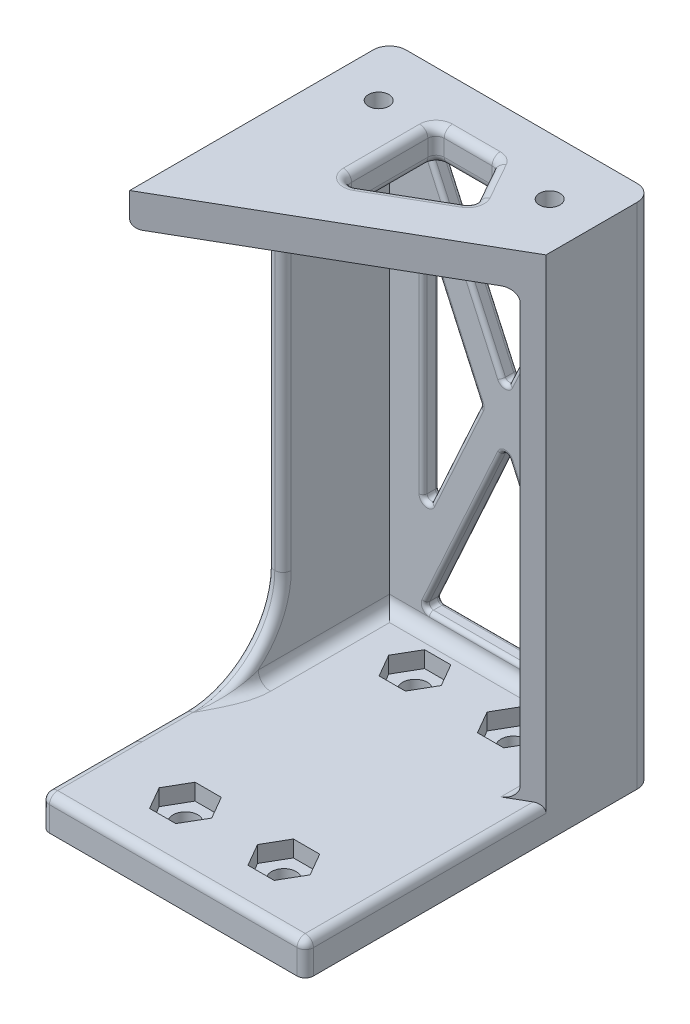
SolidWorks part; units mm, degrees
ref_plane "Front Plane" through (0, 0, 0) normal (0, 0, 1) x (1, 0, 0)
ref_plane "Top Plane" through (0, 0, 0) normal (0, 1, 0) x (1, 0, 0)
ref_plane "Right Plane" through (0, 0, 0) normal (1, 0, 0) x (0, 0, -1)
sketch "Sketch1" plane through (0, 0, 0) normal (0, 1, 0) x (1, 0, 0)
  line L1 (0, 0) -> (32.2, 0)
  line L2 (0, 0) -> (0, 34.25)
  line L3 (0, 34.25) -> (32.2, 34.25)
  line L4 (32.2, 0) -> (32.2, 34.25)
  dimension "D1" = 34.25
  dimension "D2" = 32.2
extrude "Boss-Extrude1" add sketch "Sketch1" along normal blind 4
sketch "Sketch2" plane through (0, 4, 0) normal (0, 1, 0) x (1, 0, 0)
  line L0 (32.2, 34.25) -> (0, 34.25) construction
  line L3 (16.1, 27.25) -> (10.1, 27.25) construction
  line L4 (16.1, 27.25) -> (22.1, 27.25) construction
  line L5 (16.1, 34.25) -> (16.1, 0) construction
  line L6 (0, 0) -> (32.2, 0) construction
  dimension "D1" = 6
  dimension "D2" = 7
ref_plane "Plane1" through (0, 58, 0) normal (0, 1, 0) x (1, 0, 0)
sketch "Sketch5" plane through (0, 58, 0) normal (0, 1, 0) x (1, 0, 0)
  line L1 (0, 34.25) -> (32.2, 34.25)
  line L2 (0, 34.25) -> (0, 0)
  line L3 (0, 0) -> (32.2, 0)
  line L4 (32.2, 34.25) -> (32.2, 0)
  dimension "D1" = 34.25
extrude "Boss-Extrude2" add sketch "Sketch5" along normal blind 4 separate body
sketch "Sketch6" plane through (0, 62, 0) normal (0, 1, 0) x (1, 0, 0)
  line L0 (16.1, 34.25) -> (16.1, 0) construction
  line L1 (32.2, 34.25) -> (0, 34.25) construction
  line L2 (0, 0) -> (32.2, 0) construction
  line L3 (16.1, 27.25) -> (5.67, 27.25) construction
  line L4 (16.1, 27.25) -> (26.53, 27.25) construction
  dimension "D1" = 10.43
  dimension "D2" = 7
sketch "Sketch11" plane through (0, 0, 0) normal (-1, 0, 0) x (0, 0, 1)
  line L0 (-34.25, 4) -> (-34.25, 58)
  line L1 (-34.25, 58) -> (0, 58)
  line L2 (0, 58) -> (0, 4)
  line L3 (0, 4) -> (-34.25, 4)
  line L4 (-34.25, 31) -> (0, 31) construction
extrude "Boss-Extrude3" add sketch "Sketch11" against normal blind 2
sketch "Sketch24" plane through (0, 0, 0) normal (0, -1, 0) x (1, 0, 0)
  line L0 (16.1, -34.25) -> (16.1, 71.9) construction
  line L1 (108.0286, 41.2361) -> (-3.3086, -23.0444)
  line L2 (108.0286, 18.825) -> (108.0286, 124.975) construction
  line L3 (108.0286, 124.975) -> (16.1, 178.05) construction
  line L4 (16.1, 178.05) -> (-75.8286, 124.975) construction
  line L5 (-75.8286, 124.975) -> (-75.8286, 18.825) construction
  line L6 (-75.8286, 18.825) -> (16.1, -34.25) construction
  line L7 (16.1, -34.25) -> (108.0286, 18.825) construction
  line L8 (-3.3086, -23.0444) -> (-39.5686, 39.7597)
  line L9 (108.0286, 41.2361) -> (71.7686, 104.0403)
  line L10 (-39.5686, 39.7597) -> (71.7686, 104.0403)
  circle A0 centre (16.1, 71.9) radius 91.9286 construction
  dimension "D1" = 106.15
  dimension "D2" = 72.52
extrude "Cut-Extrude6" cut sketch "Sketch24" against normal through all
sketch "Sketch26" plane through (32.2, 0, 0) normal (1, 0, 0) x (0, 0, -1)
  line L0 (34.25, 4) -> (34.25, 58)
  line L1 (34.25, 58) -> (2.5435, 58)
  line L2 (2.5435, 58) -> (2.5435, 4)
  line L3 (2.5435, 4) -> (34.25, 4)
extrude "Boss-Extrude5" add sketch "Sketch26" against normal blind 2
sketch "Sketch27" plane through (0, 58, 0) normal (0, 1, 0) x (1, 0, 0)
  line L3 (32.2, 2.5435) -> (30.2, 3.6982)
  line L4 (30.2, 3.6982) -> (30.2, 2.5435)
  line L5 (30.2, 2.5435) -> (32.2, 2.5435)
  line L6 (32.2, 2.5435) -> (30.2, 3.6982)
  line L7 (30.2, 3.6982) -> (30.2, 2.5435)
  line L8 (30.2, 2.5435) -> (32.2, 2.5435)
  dimension "D1" = 0
extrude "Cut-Extrude7" cut sketch "Sketch27" against normal through all
sketch "Sketch28" plane through (32.2, 0, 0) normal (1, 0, 0) x (0, 0, -1)
  line L3 (2.5435, 62) -> (2.5435, 0) construction
  line L7 (19.25, 4) -> (19.25, 58)
  line L8 (19.25, 58) -> (2.5435, 58)
  line L9 (2.5435, 62) -> (34.25, 62) construction
  line L10 (34.25, 0) -> (34.25, 62) construction
  line L11 (2.5435, 0) -> (34.25, 0) construction
  line L12 (19.25, 4) -> (2.5435, 4)
  line L13 (2.5435, 4) -> (2.5435, 58)
  dimension "D1" = 4
  dimension "D4" = 4
  dimension "D6" = 15
extrude "Cut-Extrude8" cut sketch "Sketch28" against normal up to next
sketch "Sketch29" plane through (0, 62, 0) normal (0, 1, 0) x (1, 0, 0)
  line L0 (20.53, 16.2094) -> (9.824, 22.3905)
  line L1 (9.824, 22.3905) -> (13.1097, 28.25)
  line L2 (13.1097, 28.25) -> (20.53, 28.25)
  line L3 (20.53, 28.25) -> (20.53, 16.2094)
  line L4 (32.2, 2.5435) -> (0, 21.1342) construction
  line L5 (32.2, 34.25) -> (0, 34.25) construction
  dimension "D1" = 6
  dimension "D2" = 6
  dimension "D3" = 6
  dimension "D4" = 6
extrude "Cut-Extrude9" cut sketch "Sketch29" against normal up to next
fillet "Fillet2" radius 2 2 edges at (32.2, 31, -34.25) (0, 31, -34.25)
sketch "Sketch31" plane through (2, 0, 0) normal (1, 0, 0) x (0, 0, -1)
  line L0 (34.25, 4) -> (34.25, 58)
  line L1 (34.25, 58) -> (32.25, 58)
  line L2 (19.9795, 58) -> (34.25, 58) construction
  line L3 (32.25, 58) -> (32.25, 4)
  line L4 (34.25, 4) -> (19.9795, 4) construction
  line L5 (32.25, 4) -> (34.25, 4)
  dimension "D1" = 2
extrude "Boss-Extrude6" add sketch "Sketch31" along normal up to next
sketch "Sketch32" plane through (0, 0, -34.25) normal (0, 0, -1) x (-1, 0, 0)
  line L0 (-16.1, 62) -> (-16.1, 0) construction
  line L1 (-30.2, 62) -> (-2, 62) construction
  line L2 (-30.2, 0) -> (-2, 0) construction
  line L3 (-32.2, 31) -> (0, 31) construction
  line L4 (-32.2, 0) -> (-32.2, 62) construction
  line L5 (0, 62) -> (0, 0) construction
  line L6 (-6.0935, 56) -> (-26.1065, 56)
  line L7 (-26.1065, 56) -> (-16.1, 34)
  line L9 (-30.2, 62) -> (-2, 0) construction
  line L10 (-6.0935, 56) -> (-16.1, 34)
  line L11 (-6.0935, 6) -> (-16.1, 28)
  line L12 (-6.0935, 6) -> (-26.1065, 6)
  line L13 (-26.1065, 6) -> (-16.1, 28)
  line L14 (-6.0935, 46.4043) -> (-6.0935, 15.5957)
  line L15 (-6.0935, 46.4043) -> (-13.1, 31)
  line L17 (-6.0935, 15.5957) -> (-13.1, 31)
  line L18 (-26.1065, 46.4043) -> (-26.1065, 15.5957)
  line L19 (-26.1065, 46.4043) -> (-19.1, 31)
  line L20 (-26.1065, 15.5957) -> (-19.1, 31)
  point P14 (-16.1, 31)
  point P29 (-6.0935, 31)
  dimension "D1" = 6
  dimension "D2" = 3
  dimension "D3" = 3
extrude "Cut-Extrude11" cut sketch "Sketch32" against normal up to next
fillet "Fillet3" radius 0.5 36 edges at (9.5968, 38.7021, -32.25) (9.5968, 38.7021, -34.25) (9.5968, 23.2979, -34.25) (9.5968, 23.2979, -32.25) (22.6032, 23.2979, -32.25) (22.6032, 23.2979, -34.25) (22.6032, 38.7021, -34.25) (22.6032, 38.7021, -32.25) (21.1032, 45, -32.25) (21.1032, 45, -34.25) (11.0968, 45, -34.25) (11.0968, 45, -32.25) (11.0968, 17, -32.25) (11.0968, 17, -34.25) (21.1032, 17, -34.25) (21.1032, 17, -32.25) (6.0935, 46.4043, -33.25) (6.0935, 31, -34.25) (6.0935, 15.5957, -33.25) (6.0935, 31, -32.25) (26.1065, 15.5957, -33.25) (26.1065, 31, -34.25) (26.1065, 46.4043, -33.25) (26.1065, 31, -32.25) (26.1065, 56, -33.25) (16.1, 56, -34.25) (6.0935, 56, -33.25) (16.1, 56, -32.25) (6.0935, 6, -33.25) (16.1, 6, -34.25) (26.1065, 6, -33.25) (16.1, 6, -32.25) (19.1, 31, -33.25) (13.1, 31, -33.25) (16.1, 34, -33.25) (16.1, 28, -33.25)
fillet "Fillet4" radius 10 2 edges at (31.2, 58, -19.25) (31.2, 4, -19.25)
fillet "Fillet5" radius 1 8 edges at (32.2, 58, -5.8968) (32.2, 55.0711, -16.3211) (32.2, 31, -19.25) (32.2, 6.9289, -16.3211) (32.2, 4, -5.8968) (30.2, 55.0711, -16.3211) (30.2, 31, -19.25) (30.2, 6.9289, -16.3211)
sketch "Sketch35" plane through (0, 4, 0) normal (0, 1, 0) x (1, 0, 0)
  line L1 (13.3043, 27.25) -> (11.7021, 30.025)
  line L2 (11.7021, 30.025) -> (8.4979, 30.025)
  line L3 (8.4979, 30.025) -> (6.8957, 27.25)
  line L4 (6.8957, 27.25) -> (8.4979, 24.475)
  line L5 (8.4979, 24.475) -> (11.7021, 24.475)
  line L6 (11.7021, 24.475) -> (13.3043, 27.25)
  line L7 (18.8957, 27.25) -> (20.4979, 24.475)
  line L8 (20.4979, 24.475) -> (23.7021, 24.475)
  line L9 (23.7021, 24.475) -> (25.3043, 27.25)
  line L10 (25.3043, 27.25) -> (23.7021, 30.025)
  line L11 (23.7021, 30.025) -> (20.4979, 30.025)
  line L12 (20.4979, 30.025) -> (18.8957, 27.25)
  line L14 (30.2, 34.25) -> (2, 34.25) construction
  circle A0 centre (10.1, 27.25) radius 2.775 construction
  circle A1 centre (22.1, 27.25) radius 2.775 construction
  dimension "D1" = 5.55
extrude "Cut-Extrude14" cut sketch "Sketch35" against normal blind 2
fillet "Fillet6" radius 1.5 8 edges at (30.4594, 58, -11.8326) (30.4594, 4, -11.8326) (2, 4, -26.1148) (2, 58, -26.1148) (16.1, 58, -32.25) (16.1, 4, -32.25) (30.2, 58, -23.0413) (30.2, 4, -23.0413)
sketch "Sketch37" plane through (0, 4, 0) normal (0, 1, 0) x (1, 0, 0)
  circle A0 centre (10.1, 27.25) radius 1.5
  circle A1 centre (22.1, 27.25) radius 1.5
  dimension "D1" = 3
extrude "Cut-Extrude15" cut sketch "Sketch37" against normal blind 10
sketch "Sketch38" plane through (0, 62, 0) normal (0, 1, 0) x (1, 0, 0)
  circle A0 centre (5.67, 27.25) radius 1.25
  circle A1 centre (26.53, 27.25) radius 1.25
  dimension "D1" = 2.5
extrude "Cut-Extrude16" cut sketch "Sketch38" against normal up to next
sketch "Sketch39" plane through (0, 0, 0) normal (0, -1, 0) x (1, 0, 0)
  line L0 (0, -21.1342) -> (0, 8.2337)
  line L1 (0, 8.2337) -> (32.2, 8.2337)
  line L2 (32.2, 8.2337) -> (32.2, -2.5435)
  line L3 (32.2, -2.5435) -> (0, -21.1342)
  line L4 (16.1, -27.25) -> (16.1, 0.75) construction
  line L5 (16.1, 0.75) -> (10.1, 0.75) construction
  line L6 (16.1, 0.75) -> (22.1, 0.75) construction
  line L7 (16.1, -27.25) -> (10.1, -27.25) construction
  circle A0 centre (10.1, 0.75) radius 1.5
  circle A1 centre (22.1, 0.75) radius 1.5
  circle A2 centre (10.1, -27.25) radius 1.5 construction
  dimension "D1" = 28
extrude "Boss-Extrude7" add sketch "Sketch39" against normal blind 4
fillet "Fillet7" radius 1 5 edges at (32.2, 4, 2.8451) (0, 4, -6.4503) (0, 2, 8.2337) (32.2, 2, 8.2337) (16.1, 4, 8.2337)
sketch "Sketch40" plane through (0, 4, 0) normal (0, 1, 0) x (1, 0, 0)
  line L0 (1, -7.2337) -> (31.2, -7.2337) construction
  line L1 (8.4979, -3.525) -> (11.7021, -3.525)
  line L2 (11.7021, -3.525) -> (13.3043, -0.75)
  line L3 (13.3043, -0.75) -> (11.7021, 2.025)
  line L4 (11.7021, 2.025) -> (8.4979, 2.025)
  line L5 (8.4979, 2.025) -> (6.8957, -0.75)
  line L6 (6.8957, -0.75) -> (8.4979, -3.525)
  line L7 (20.4979, -3.525) -> (23.7021, -3.525)
  line L8 (23.7021, -3.525) -> (25.3043, -0.75)
  line L9 (25.3043, -0.75) -> (23.7021, 2.025)
  line L10 (23.7021, 2.025) -> (20.4979, 2.025)
  line L11 (20.4979, 2.025) -> (18.8957, -0.75)
  line L12 (18.8957, -0.75) -> (20.4979, -3.525)
  circle A0 centre (10.1, -0.75) radius 2.775 construction
  circle A1 centre (22.1, -0.75) radius 2.775 construction
  dimension "D1" = 5.55
extrude "Cut-Extrude17" cut sketch "Sketch40" against normal blind 2
fillet "Fillet8" radius 1 12 edges at (16.8199, 58, -28.25) (16.8199, 62, -28.25) (15.177, 62, -19.3) (15.177, 58, -19.3) (9.824, 60, -22.3905) (11.4669, 62, -25.3203) (13.1097, 60, -28.25) (11.4669, 58, -25.3203) (20.53, 60, -28.25) (20.53, 62, -22.2297) (20.53, 60, -16.2094) (20.53, 58, -22.2297)
mirror "Mirror1" about plane through (32.2, 4, 0) normal (-1, 0, 0)
sketch "Sketch41" plane through (0, 0, 0) normal (0, -1, 0) x (-1, 0, 0)
  line L2 (-32.2, 32.25) -> (-32.2, -12.6206)
  line L3 (-32.2, -12.6206) -> (5.8236, -12.6206)
  line L4 (5.8236, 32.25) -> (5.8236, -12.6206)
  line L6 (-32.2, 32.25) -> (-32.2, 36.735)
  line L7 (-32.2, 36.735) -> (5.8236, 36.735)
  line L8 (5.8236, 32.25) -> (5.8236, 36.735)
extrude "Cut-Extrude18" cut sketch "Sketch41" against normal through all
